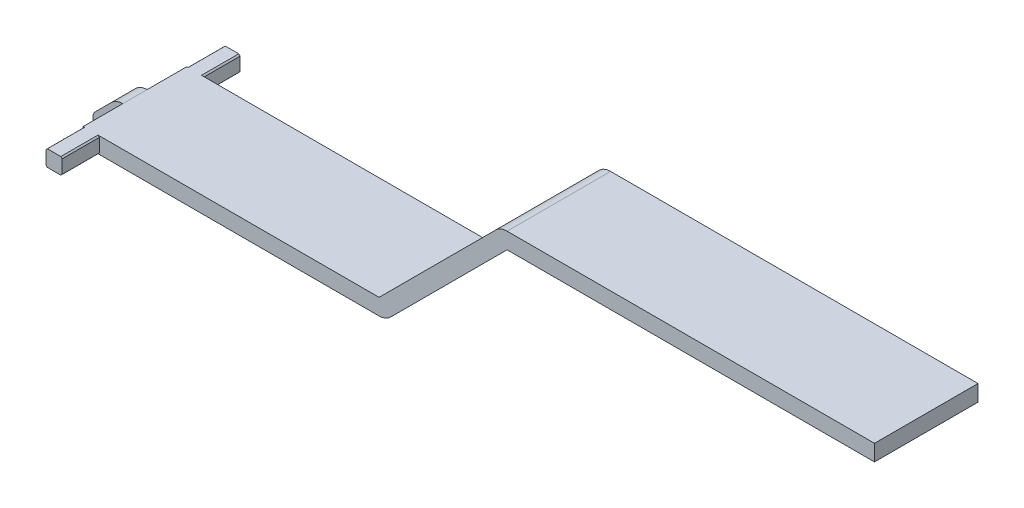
SolidWorks part; units mm, degrees
ref_plane "Plan de face" through (0, 0, 0) normal (0, 0, 1) x (1, 0, 0)
ref_plane "Plan de dessus" through (0, 0, 0) normal (0, 1, 0) x (1, 0, 0)
ref_plane "Plan de droite" through (0, 0, 0) normal (1, 0, 0) x (0, 0, -1)
sketch "Esquisse1" plane through (0, 0, 0) normal (0, 0, 1) x (1, 0, 0)
  line L0 (0, 0) -> (18, 0) construction
  line L1 (18, 0) -> (25.5, 7.5) construction
  line L2 (25.5, 7.5) -> (48.4226, 7.5) construction
  line L3 (0, -0.5) -> (18.2071, -0.5)
  line L4 (18.2071, -0.5) -> (25.7071, 7)
  line L5 (25.7071, 7) -> (48.4226, 7)
  line L6 (0, 0.5) -> (17.7929, 0.5)
  line L7 (17.7929, 0.5) -> (25.2929, 8)
  line L8 (25.2929, 8) -> (48.4226, 8)
  line L9 (48.4226, 8) -> (48.4226, 7)
  line L10 (0, -0.5) -> (18.2071, -0.5) construction
  line L11 (0, 0.5) -> (-0.5, 0.5)
  line L12 (-0.5, 0.5) -> (-0.5, -0.5)
  line L13 (-0.5, -0.5) -> (0, -0.5)
  line L14 (0.5, 0.5) -> (0.5, -0.5) construction
  arc A0 (0, 0.5) -> (0, -0.5) centre (0, 0) ccw construction
  circle A1 centre (0, 0) radius 0.65 construction
  dimension "D4" = 49
  dimension "D7" = 1.3
  dimension "D1" = 18
  dimension "D2" = 135
  dimension "D3" = 7.5
  dimension "D5" = 0.5
  dimension "D6" = 0.5
extrude "Boss.-Extru.1" add sketch "Esquisse1" along normal mid plane 6.4
sketch "Esquisse2" plane through (0, 0, 0) normal (0, 0, 1) x (1, 0, 0)
  line L0 (-0.5, 0.5) -> (-0.5, -0.5) construction
  line L1 (0.5, 0.5) -> (0.5, -0.5) construction
  line L2 (-0.5, 0.5) -> (-0.5, -0.5)
  line L3 (0.5, 0.5) -> (0.5, -0.5)
  line L4 (-0.5, 0.5) -> (0.5, 0.5)
  line L5 (-0.5, -0.5) -> (0.5, -0.5)
extrude "Boss.-Extru.2" add sketch "Esquisse2" along normal mid plane 11
sketch "Esquisse3" plane through (0, 0, 5.5) normal (0, 0, 1) x (1, 0, 0)
  circle A0 centre (0, 0) radius 0.65
  dimension "D1" = 1.3
extrude "Enlèv. mat.-Extru.1" cut sketch "Esquisse3" against normal up to surface (2.3 mm away) flip side to cut
sketch "Esquisse4" plane through (0, 0, -5.5) normal (0, 0, -1) x (-1, 0, 0)
  circle A0 centre (0, 0) radius 0.65 construction
  circle A1 centre (0, 0) radius 0.65
extrude "Enlèv. mat.-Extru.2" cut sketch "Esquisse4" against normal up to surface (2.3 mm away) flip side to cut
sketch "Esquisse5" plane through (0, 0, 0) normal (0, 0, 1) x (1, 0, 0)
  line L0 (-0.5, 0.5) -> (-0.4153, 0.5) construction
  line L1 (-0.5, 0.4153) -> (-0.5, 0.5) construction
  line L2 (-0.5, -0.5) -> (-0.5, -0.4153) construction
  line L3 (-0.4153, -0.5) -> (-0.5, -0.5) construction
  line L4 (-0.5, 0.5) -> (-0.4153, 0.5)
  line L5 (-0.5, 0.4153) -> (-0.5, 0.5)
  line L6 (-0.5, -0.5) -> (-0.5, -0.4153)
  line L7 (-0.4153, -0.5) -> (-0.5, -0.5)
  arc A0 (-0.4153, 0.5) -> (-0.5, 0.4153) centre (0, 0) ccw construction
  arc A1 (-0.5, -0.4153) -> (-0.4153, -0.5) centre (0, 0) ccw construction
  arc A2 (-0.4153, 0.5) -> (-0.5, 0.4153) centre (0, 0) ccw
  arc A3 (-0.5, -0.4153) -> (-0.4153, -0.5) centre (0, 0) ccw
sketch "Esquisse6" plane through (0, 0, 0) normal (0, 0, 1) x (1, 0, 0)
  line L0 (-0.5, -0.5) -> (-1.5036, -1.5036)
  line L1 (0, 0) -> (18, 0) construction
  line L2 (-2.2107, -0.7964) -> (-1.2071, 0.2071)
  line L4 (0, -0.5) -> (18.2071, -0.5) construction
  line L7 (-0.5, 0.5) -> (-0.5, -0.5) construction
  line L8 (-0.5, 0.5) -> (-0.5, -0.5)
  line L9 (-1.8571, -1.15) -> (-2.2107, -1.5036) construction
  arc A0 (-0.5, 0.5) -> (-1.2071, 0.2071) centre (-0.5, -0.5) ccw
  arc A1 (-2.2107, -0.7964) -> (-1.5036, -1.5036) centre (-1.8571, -1.15) ccw
  point P1 (-1.9768, -1.9768)
  point P4 (-2.6839, -1.2697)
  dimension "D1" = 135
  dimension "D2" = 1.15
extrude "Boss.-Extru.3" add sketch "Esquisse6" along normal mid plane 1.5
fillet "Congé1" radius 1 2 edges at (25.2929, 8, 0) (18.2071, -0.5, 0)
